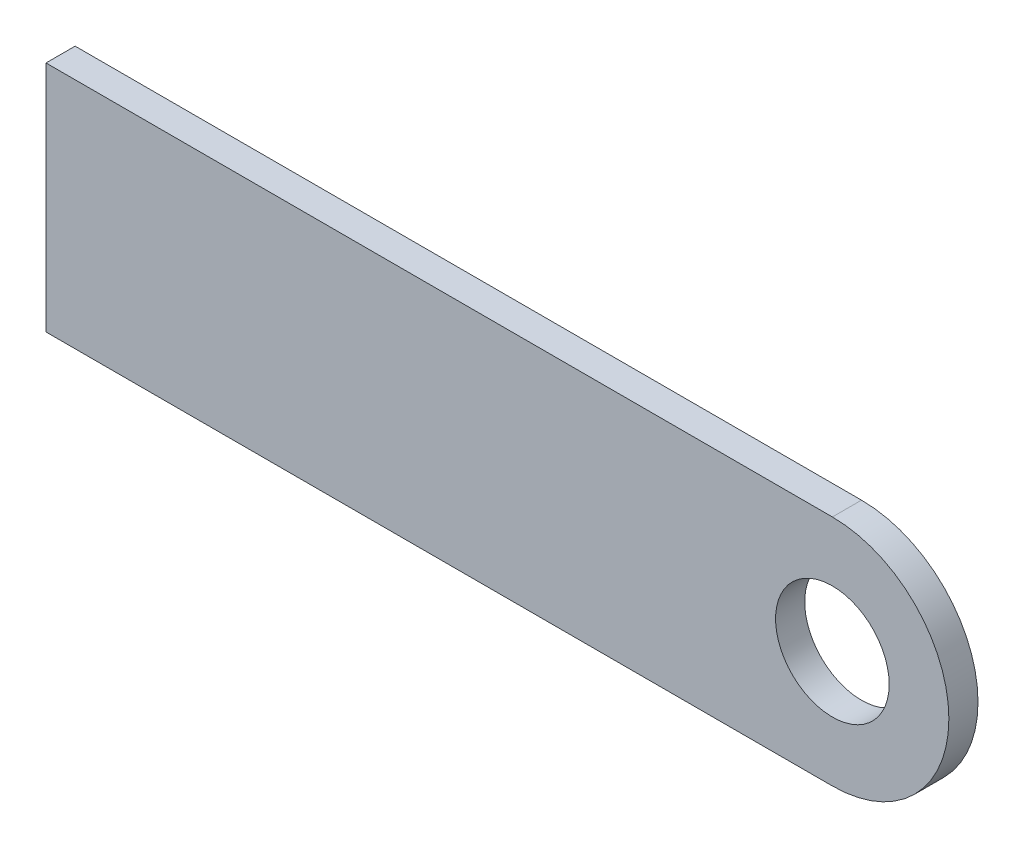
SolidWorks part; units mm, degrees
ref_plane "Piano frontale" through (0, 0, 0) normal (0, 0, 1) x (1, 0, 0)
ref_plane "Piano superiore" through (0, 0, 0) normal (0, 1, 0) x (1, 0, 0)
ref_plane "Piano destro" through (0, 0, 0) normal (1, 0, 0) x (0, 0, -1)
sketch "Schizzo1" plane through (0, 0, 0) normal (0, 0, 1) x (1, 0, 0)
  line L1 (-67.5, 20) -> (67.5, 20)
  line L2 (-67.5, 20) -> (-67.5, -20)
  line L3 (-67.5, -20) -> (67.5, -20)
  line L5 (-67.5, 20) -> (67.5, -20) construction
  line L6 (-67.5, -20) -> (67.5, 20) construction
  arc A0 (67.5, 20) -> (67.5, -20) centre (67.5, 0) cw
  circle A1 centre (67.5, 0) radius 9.75
  point P0 (0, 0)
  dimension "D3" = 19.5
  dimension "D1" = 40
  dimension "D2" = 135
base flange "Base-Flangia1" sketch "Schizzo1" thickness 5 reverse thickness direction no parameters "D1"=1.5
sketch "Linee di piegatura1" [suppressed] plane through (0, 0, 0) normal (0, 1, 0) x (1, 0, 0)
sketch "Casella di contorno1" [suppressed] plane through (0, 0, 0) normal (0, 1, 0) x (1, 0, 0)
sheet metal parameters "Lamiera1" thickness 5 parameters "D1"=1.5
flat pattern "Ripetizione piatta1"
sketch "Linee di piegatura2" plane through (0, 0, 0) normal (0, 1, 0) x (1, 0, 0)
sketch3d "Casella di contorno2" [suppressed]
  line L0 (-135, -20, 0) -> (20, -20, 0) construction
  line L1 (-135, 20, 0) -> (20, 20, 0) construction
  line L2 (-135, -20, 0) -> (-135, 20, 0) construction
  line L3 (20, -20, 0) -> (20, 20, 0) construction
